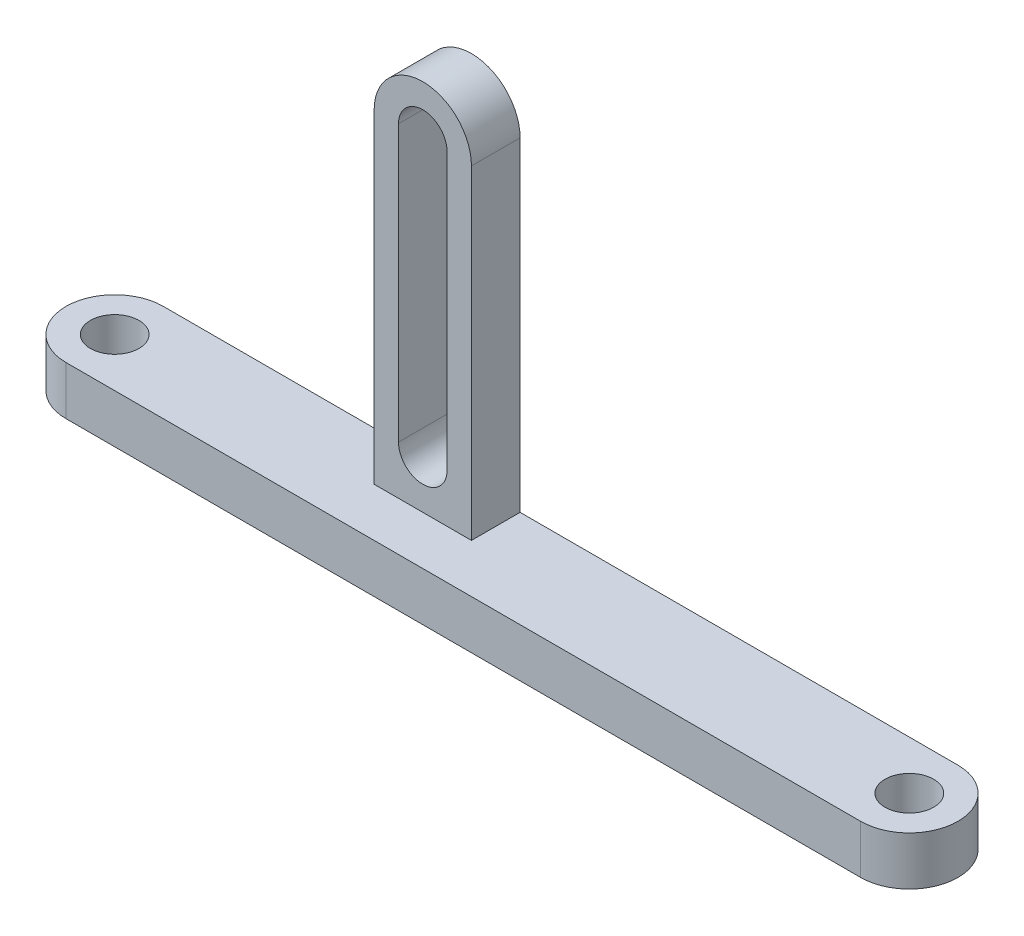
SolidWorks part; units mm, degrees
ref_plane "Front Plane" through (0, 0, 0) normal (0, 0, 1) x (1, 0, 0)
ref_plane "Top Plane" through (0, 0, 0) normal (0, 1, 0) x (1, 0, 0)
ref_plane "Right Plane" through (0, 0, 0) normal (1, 0, 0) x (0, 0, -1)
sketch "Sketch1" plane through (0, 0, 0) normal (0, 0, 1) x (1, 0, 0)
  line L0 (0, 0) -> (0, 17) construction
  line L1 (-1.5, 0) -> (-1.5, 17)
  line L2 (1.5, 0) -> (1.5, 17)
  line L3 (0, 17) -> (0, 0) construction
  line L4 (3, 17) -> (3, 0)
  line L5 (-3, 17) -> (-3, 0)
  line L6 (-3, 0) -> (-3, -3)
  line L11 (-3, -3) -> (3, -3)
  line L12 (3, -3) -> (3, 0)
  arc A0 (-1.5, 0) -> (1.5, 0) centre (0, 0) ccw
  arc A1 (1.5, 17) -> (-1.5, 17) centre (0, 17) ccw
  arc A2 (3, 17) -> (-3, 17) centre (0, 17) ccw
  arc A3 (-3, 0) -> (3, 0) centre (0, 0) ccw
  point P3 (0, 8.5)
  point P10 (0, 8.5)
  point P15 (0, -3)
  dimension "2.5/2" = 1.5
  dimension "D3" = 3
  dimension "D2" = 17
extrude "Boss-Extrude1" add sketch "Sketch1" along normal blind 3 contours L5 A3 L4 A2 A1 L2 A0 L1 | A3 L11 L12 | A3 L6 L11
sketch "Sketch2" plane through (0, -3, 0) normal (0, -1, 0) x (1, 0, 0)
  line L0 (-19, 3) -> (30, 3) construction
  line L1 (-19, 6) -> (30, 6)
  line L2 (-19, 0) -> (30, 0)
  line L3 (-3, 0) -> (3, 0) construction
  line L4 (0, 0) -> (0, 16.4633) construction
  arc A0 (-19, 6) -> (-19, 0) centre (-19, 3) ccw
  arc A1 (30, 0) -> (30, 6) centre (30, 3) ccw
  circle A2 centre (-19, 3) radius 1.5
  circle A3 centre (30, 3) radius 1.5
  point P2 (5.5, 3)
  dimension "D1" = 3
  dimension "D4" = 3
  dimension "D5" = 3
  dimension "D2" = 49
  dimension "D3" = 5.5
extrude "Boss-Extrude2" add sketch "Sketch2" along normal blind 3
